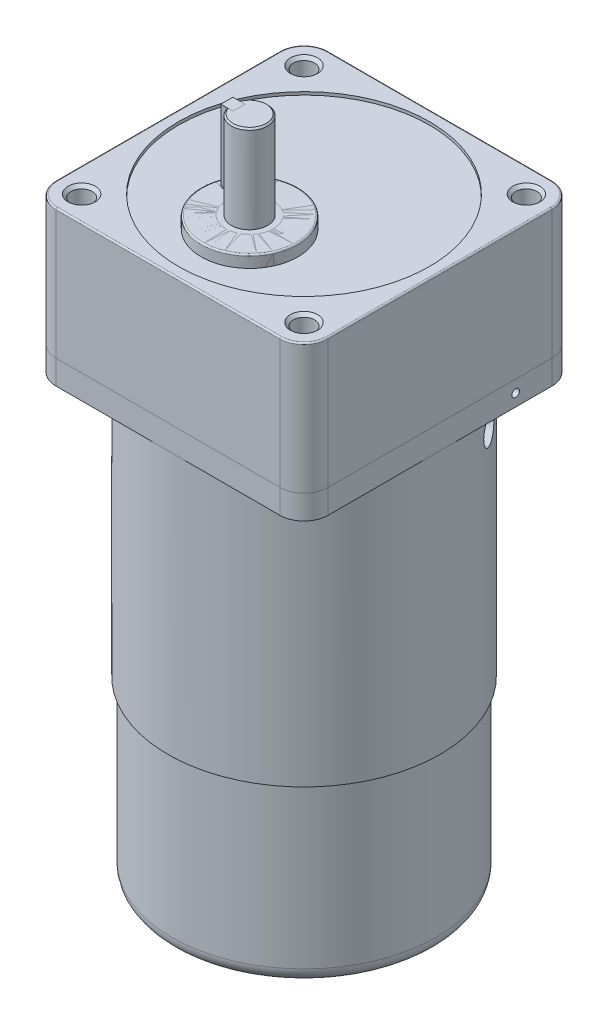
SolidWorks part; units mm, degrees
ref_plane "前视基准面" through (0, 0, 0) normal (0, 0, 1) x (1, 0, 0)
ref_plane "上视基准面" through (0, 0, 0) normal (0, 1, 0) x (1, 0, 0)
ref_plane "右视基准面" through (0, 0, 0) normal (1, 0, 0) x (0, 0, -1)
imported_body "复件 (5) 51k40cc-00机壳 9024.0040.106-00-1-surface1"
imported_body "复件 (5) 51k40cc-00机壳 9024.0040.106-00-1-surface2"
imported_body "9050.0018.101.01箱体-1-surface1"
imported_body "9050.0018.101.01箱体-1-surface2"
imported_body "9050.0018.101.01箱体-1-surface3"
imported_body "9050.0018.101.01箱体-1-surface4"
imported_body "9050.0018.101.01箱体-1-surface5"
sketch "草图1" plane through (0, 103.091, 0) normal (0, 1, 0) x (1, 0, 0)
  circle A0 centre (-26.1828, -18) radius 16
extrude "凸台-拉伸1" add sketch "草图1" along normal blind 4
fillet "圆角1" radius 0.5 1 edges at (-42.1828, 107.091, 18)
sketch "草图3" plane through (0, 107.091, 0) normal (0, 1, 0) x (1, 0, 0)
  circle A0 centre (-26.1828, -18) radius 6
extrude "凸台-拉伸2" add sketch "草图3" along normal blind 29
chamfer "倒角1" distance 0.5 angle 45 1 edges at (-32.1828, 136.091, 18)
ref_plane "基准面1" through (-32.191, 0, 0) normal (1, 0, 0) x (0, 0, -1)
sketch "草图4" plane through (-32.191, 0, 0) normal (1, 0, 0) x (0, 0, -1)
  line L1 (-12.5, 136.091) -> (-23.5, 136.091) construction
  line L2 (-16, 113.091) -> (-16, 136.091)
  line L3 (-16, 136.091) -> (-20, 136.091)
  line L4 (-20, 136.091) -> (-20, 113.091)
  arc A0 (-20, 113.091) -> (-16, 113.091) centre (-18, 113.091) ccw
extrude "切除-拉伸2" cut sketch "草图4" along normal blind 2.5
sketch "草图5" plane through (-29.691, 0, 0) normal (-1, 0, 0) x (0, 0, 1)
  line L0 (16, 113.091) -> (16, 136.091)
  line L1 (16, 136.091) -> (20, 136.091)
  line L2 (20, 136.091) -> (20, 113.091)
  arc A0 (16, 113.091) -> (20, 113.091) centre (18, 113.091) ccw
extrude "凸台-拉伸3" add sketch "草图5" along normal blind 4 separate body
